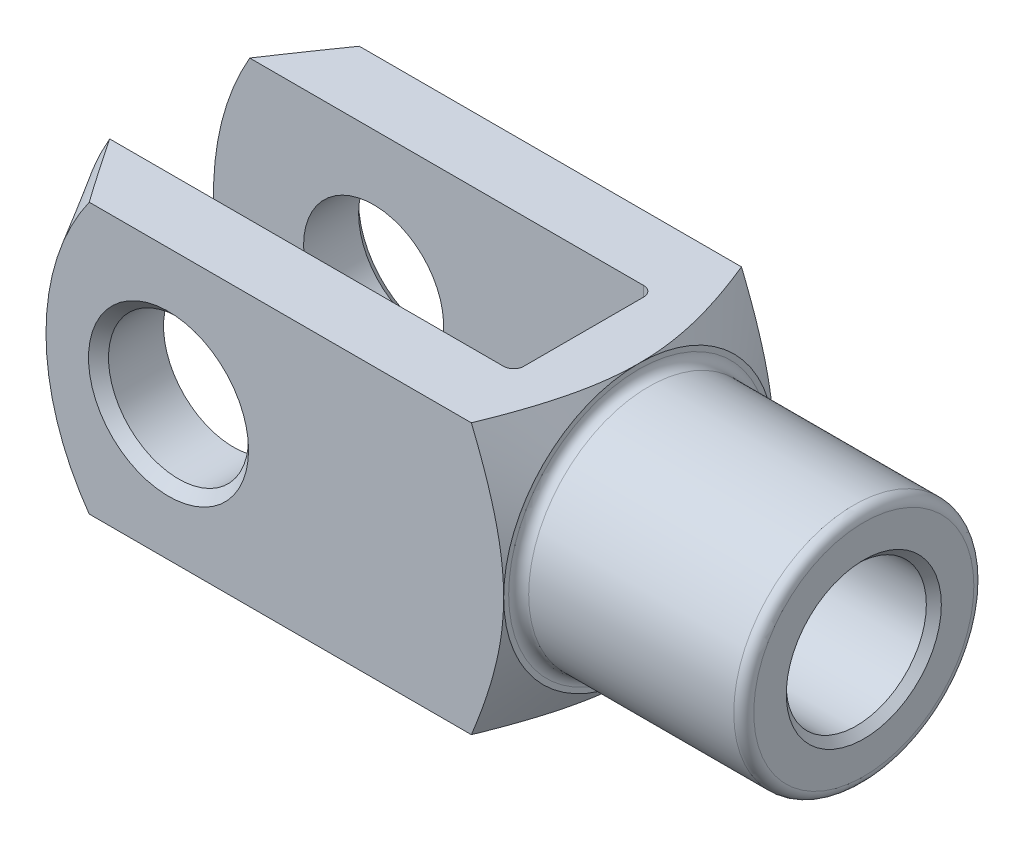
SolidWorks part; units mm, degrees
ref_plane "Front Plane" through (0, 0, 0) normal (0, 0, 1) x (1, 0, 0)
ref_plane "Top Plane" through (0, 0, 0) normal (0, 1, 0) x (1, 0, 0)
ref_plane "Right Plane" through (0, 0, 0) normal (1, 0, 0) x (0, 0, -1)
sketch "Sketch1" plane through (0, 0, 0) normal (1, 0, 0) x (0, 0, -1)
  line L0 (0, 0) -> (0, 50000) construction
  line L1 (0, 0) -> (50000, 0) construction
  line L2 (-13.5, -13.5) -> (-13.5, 13.5)
  line L3 (-13.5, 13.5) -> (13.5, 13.5)
  line L4 (13.5, -13.5) -> (13.5, 13.5)
  line L5 (-13.5, -13.5) -> (13.5, -13.5)
  point P9 (0, 13.5)
  point P11 (13.5, 0)
  point P12 (-13.5, 0)
  dimension "D1" = 27
  dimension "D2" = 27
extrude "Extrude1" add sketch "Sketch1" against normal blind 72
sketch "Sketch2" plane through (0, 0, 0) normal (1, 0, 0) x (0, 0, -1)
  circle A0 centre (0, 0) radius 12
  circle A1 centre (0, 0) radius 24
  dimension "D1" = 24
  dimension "D2" = 48
extrude "Extrude2" cut sketch "Sketch2" against normal blind 22.5
sketch "Sketch3" plane through (0, 0, 13.5) normal (0, 0, 1) x (1, 0, 0)
  circle A0 centre (-56, 0) radius 7
  dimension "D1" = 14
  dimension "D2" = 56
extrude "Extrude3" cut sketch "Sketch3" against normal through all
sketch "Sketch4" plane through (0, 13.5, 0) normal (0, 1, 0) x (1, 0, 0)
  line L0 (0, 0) -> (-50000, 0) construction
  line L1 (-72, -7) -> (-72, 7)
  line L2 (-72, 13.5) -> (-72, -13.5) construction
  line L3 (-72, 7) -> (-28, 7)
  line L4 (-28, 7) -> (-28, -7)
  line L5 (-56, 13.5) -> (-56, -13.5) construction
  line L6 (-72, -7) -> (-28, -7)
  point P7 (-56, 0)
  point P13 (-28, 0)
  point P14 (-72, 0)
  dimension "D1" = 28
  dimension "D2" = 14
extrude "Extrude4" cut sketch "Sketch4" against normal through all
fillet "Fillet1" radius 1 2 edges at (-28, 0, 7) (-28, 0, -7)
fillet "Fillet2" radius 1 2 edges at (0, 0, -12) (-22.5, 0, -12)
chamfer "Chamfer2" distance 1 angle 45 2 edges at (-49, 0, -13.5) (-49, 0, 13.5)
sketch "Sketch6" plane through (0, 0, 0) normal (0, 0, 1) x (1, 0, 0)
  line L0 (-22.5, -13.5) -> (-22.5, -27)
  line L1 (-22.5, -27) -> (-30.2942, -27)
  line L2 (-30.2942, -27) -> (-22.5, -13.5)
  dimension "D1" = 30
  dimension "D2" = 27
revolve "Cut-Revolve1" cut sketch "Sketch6" angle 360 about axis through (-22.5, 0, 0) along (1, 0, 0)
sketch "Sketch7" plane through (0, 0, 0) normal (0, 1, 0) x (1, 0, 0)
  line L0 (-68.2472, -13.5) -> (-72, -7)
  line L1 (-72, 7) -> (-68.2472, 13.5)
  line L2 (-68.2472, 13.5) -> (-99, 13.5)
  line L3 (-72, 7) -> (-72, -7)
  line L4 (-99, 13.5) -> (-99, -13.5)
  line L5 (-99, -13.5) -> (-68.2472, -13.5)
  line L6 (-72, 13.5) -> (-25.7285, 13.5) construction
  line L7 (-72, -13.5) -> (-25.7285, -13.5) construction
  line L8 (-45, 0.6162) -> (-45, 50000.6162) construction
  dimension "D1" = 120
  dimension "D2" = 27
  dimension "D3" = 27
revolve "Cut-Revolve2" cut sketch "Sketch7" angle 180 about L8
sketch "Sketch8" plane through (0, 0, 0) normal (1, 0, 0) x (0, 0, -1)
  circle A0 centre (0, 0) radius 7
  dimension "D1" = 14
extrude "Extrude5" cut sketch "Sketch8" against normal through all
chamfer "Chamfer3" distance 0.75 angle 45 1 edges at (0, 0, -7)
equation "\"D2@Sketch1\" = \"D1@Sketch1\""
equation "\"D2@Sketch2\" = \"D1@Sketch2\"*2"
equation "\"D2@Sketch6\" = \"D1@Sketch1\""
equation "\"D2@Sketch7\" = \"D1@Sketch1\""
equation "\"D3@Sketch7\" = \"D1@Sketch1\""
